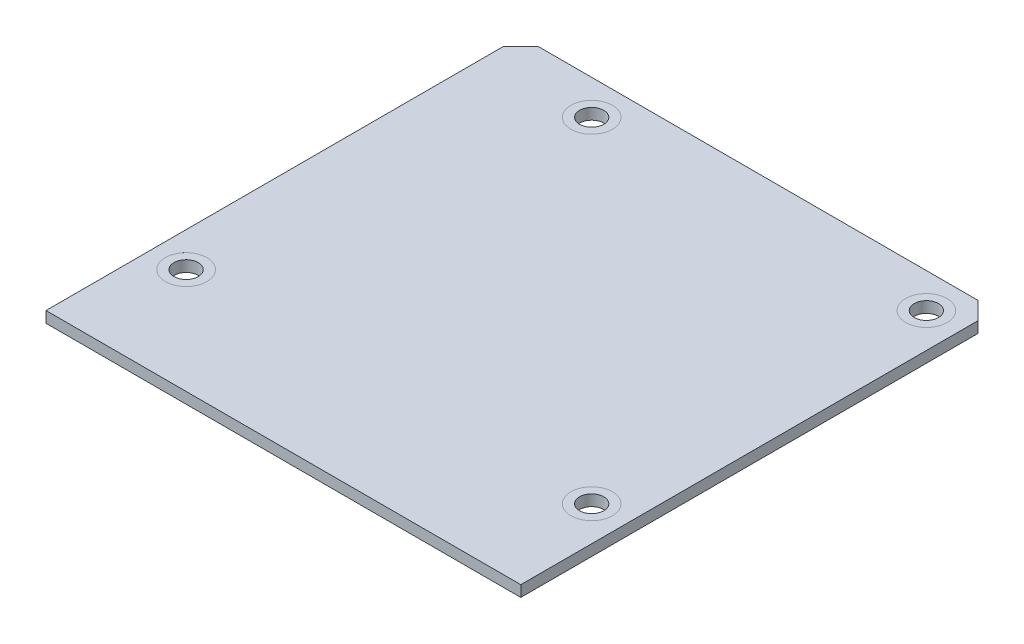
SolidWorks part; units mm, degrees
ref_plane "Front Plane" through (0, 0, 0) normal (0, 0, 1) x (1, 0, 0)
ref_plane "Top Plane" through (0, 0, 0) normal (0, 1, 0) x (1, 0, 0)
ref_plane "Right Plane" through (0, 0, 0) normal (1, 0, 0) x (0, 0, -1)
sketch "Sketch1" plane through (0, 0, 0) normal (0, 1, 0) x (1, 0, 0)
  line L1 (-34.29, 34.29) -> (34.29, 34.29)
  line L2 (-34.29, 34.29) -> (-34.29, -34.29)
  line L3 (-34.29, -34.29) -> (34.29, -34.29)
  line L4 (34.29, 34.29) -> (34.29, -34.29)
  line L5 (-34.29, 34.29) -> (34.29, -34.29) construction
  line L6 (-34.29, -34.29) -> (34.29, 34.29) construction
  point P0 (0, 0)
  dimension "D1" = 68.58
  dimension "D2" = 68.58
extrude "Boss-Extrude1" add sketch "Sketch1" along normal blind 1.6
chamfer "Chamfer1" distance 2.54 angle 45 2 edges at (34.29, 0.8, -34.29) (-34.29, 0.8, -34.29)
sketch "Sketch2" plane through (0, 1.6, 0) normal (0, 1, 0) x (1, 0, 0)
  line L0 (-34.29, 31.75) -> (-34.29, -34.29) construction
  line L1 (-34.29, -34.29) -> (34.29, -34.29) construction
  line L2 (34.29, -34.29) -> (34.29, 31.75) construction
  line L3 (31.75, 34.29) -> (-31.75, 34.29) construction
  circle A0 centre (-19.05, 29.29) radius 1.75
  circle A1 centre (29.29, 29.29) radius 1.75
  circle A2 centre (29.29, -19.05) radius 1.75
  circle A3 centre (-29.29, -19.05) radius 1.75
  dimension "D1" = 3.5
  dimension "D2" = 3.5
  dimension "D3" = 3.5
  dimension "D4" = 3.5
  dimension "D6" = 5
  dimension "D9" = 5
  dimension "D7" = 5
  dimension "D5" = 15.24
  dimension "D8" = 15.24
extrude "Cut-Extrude1" cut sketch "Sketch2" against normal up to next
sketch "Sketch3" plane through (0, 1.6, 0) normal (0, 1, 0) x (1, 0, 0)
  circle A0 centre (-19.05, 29.29) radius 3
  circle A1 centre (29.29, 29.29) radius 3
  circle A2 centre (-29.29, -19.05) radius 3
  circle A3 centre (29.29, -19.05) radius 3
  dimension "D1" = 6
extrude "Cut-Extrude2" cut sketch "Sketch3" against normal blind 0.0001
